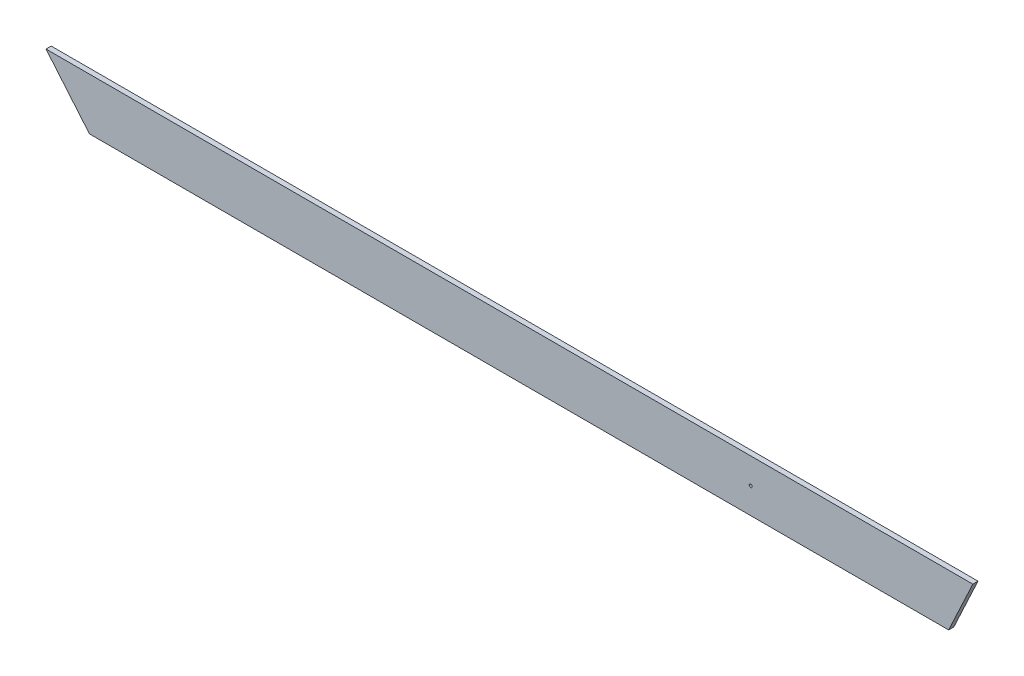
SolidWorks part; units mm, degrees
ref_plane "Front Plane" through (0, 0, 0) normal (0, 0, 1) x (1, 0, 0)
ref_plane "Top Plane" through (0, 0, 0) normal (0, 1, 0) x (1, 0, 0)
ref_plane "Right Plane" through (0, 0, 0) normal (1, 0, 0) x (0, 0, -1)
sketch "Sketch1" plane through (0, 0, 0) normal (0, 0, 1) x (1, 0, 0)
  line L0 (-405.545, 0) -> (424.1846, 0)
  line L1 (-447.5, 50) -> (447.5, 50)
  line L2 (-405.545, 0) -> (-447.5, 50)
  line L3 (424.1846, 0) -> (447.5, 50)
  point P4 (0, 50)
  dimension "D2" = 895
  dimension "D3" = 50
  dimension "D4" = 65
  dimension "D1" = 50
extrude "Boss-Extrude1" add sketch "Sketch1" along normal blind 5
sketch "Sketch2" plane through (0, 0, 5) normal (0, 0, 1) x (1, 0, 0)
  line L0 (-405.545, 0) -> (424.1846, 0) construction
  circle A0 centre (233, 25) radius 1.5
  dimension "D1" = 3
  dimension "D2" = 233
  dimension "D3" = 25
extrude "Cut-Extrude1" cut sketch "Sketch2" against normal blind 10
